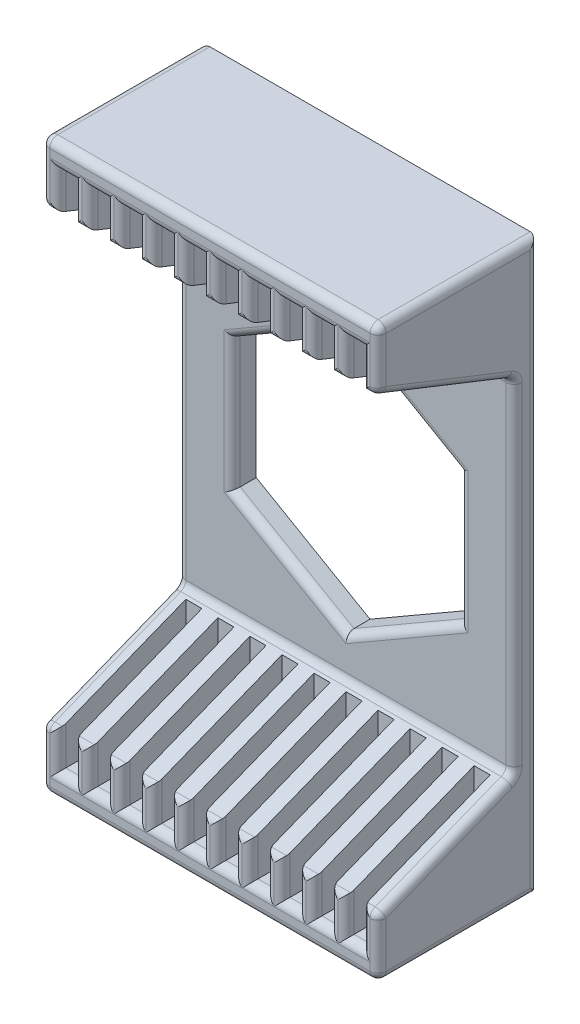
SolidWorks part; units mm, degrees
ref_plane "Front Plane" through (0, 0, 0) normal (1, 0, 0) x (0, 1, 0)
ref_plane "Top Plane" through (0, 0, 0) normal (0, 0, 1) x (0, 1, 0)
ref_plane "Right Plane" through (0, 0, 0) normal (0, 1, 0) x (-1, 0, 0)
sketch "Sketch1" plane through (0, 0, 0) normal (1, 0, 0) x (0, 1, 0)
  line L1 (0, 0) -> (90.17, 0)
  line L2 (0, 0) -> (0, 25.4)
  line L3 (0, 25.4) -> (90.17, 25.4)
  line L4 (90.17, 0) -> (90.17, 25.4)
  dimension "D1" = 90.17
  dimension "D2" = 25.4
extrude "Boss-Extrude1" add sketch "Sketch1" along normal blind 53.34
sketch "Sketch2" plane through (53.34, 0, 0) normal (1, 0, 0) x (0, 1, 0)
  line L0 (9.4138, 25.4) -> (80.7562, 25.4) construction
  line L1 (90.17, 25.4) -> (0, 25.4) construction
  line L2 (45.085, 25.4) -> (45.085, 3.81) construction
  line L3 (17.9566, 3.81) -> (72.2134, 3.81)
  line L4 (72.2134, 3.81) -> (80.7562, 25.4)
  line L5 (80.7562, 25.4) -> (9.4138, 25.4)
  line L6 (9.4138, 25.4) -> (17.9566, 3.81)
  point P5 (45.085, 25.4)
  point P10 (45.085, 3.81)
extrude "Cut-Extrude1" cut sketch "Sketch2" against normal through all
sketch "Sketch4" plane through (0, 0, 25.4) normal (0, 0, 1) x (1, 0, 0)
  line L0 (0, 90.17) -> (2.54, 90.17) construction
  line L1 (53.34, 90.17) -> (0, 90.17) construction
  line L2 (2.54, 90.17) -> (2.54, 86.36) construction
  line L3 (0, 0) -> (2.54, 0) construction
  line L4 (53.34, 0) -> (0, 0) construction
  line L5 (2.54, 0) -> (2.54, 3.81) construction
  line L6 (2.54, 86.36) -> (5.08, 86.36)
  line L7 (5.08, 86.36) -> (5.08, 3.81)
  line L8 (5.08, 3.81) -> (2.54, 3.81)
  line L9 (2.54, 3.81) -> (2.54, 86.36)
  line L10 (7.62, 3.81) -> (7.62, 86.36)
  line L11 (7.62, 86.36) -> (10.16, 86.36)
  line L12 (10.16, 86.36) -> (10.16, 3.81)
  line L13 (10.16, 3.81) -> (7.62, 3.81)
  line L14 (12.7, 3.81) -> (12.7, 86.36)
  line L15 (12.7, 86.36) -> (15.24, 86.36)
  line L16 (15.24, 86.36) -> (15.24, 3.81)
  line L17 (15.24, 3.81) -> (12.7, 3.81)
  line L18 (17.78, 3.81) -> (17.78, 86.36)
  line L19 (17.78, 86.36) -> (20.32, 86.36)
  line L20 (20.32, 86.36) -> (20.32, 3.81)
  line L21 (20.32, 3.81) -> (17.78, 3.81)
  line L22 (22.86, 3.81) -> (22.86, 86.36)
  line L23 (22.86, 86.36) -> (25.4, 86.36)
  line L24 (25.4, 86.36) -> (25.4, 3.81)
  line L25 (25.4, 3.81) -> (22.86, 3.81)
  line L26 (27.94, 3.81) -> (27.94, 86.36)
  line L27 (27.94, 86.36) -> (30.48, 86.36)
  line L28 (30.48, 86.36) -> (30.48, 3.81)
  line L29 (30.48, 3.81) -> (27.94, 3.81)
  line L30 (33.02, 3.81) -> (33.02, 86.36)
  line L31 (33.02, 86.36) -> (35.56, 86.36)
  line L32 (35.56, 86.36) -> (35.56, 3.81)
  line L33 (35.56, 3.81) -> (33.02, 3.81)
  line L34 (38.1, 3.81) -> (38.1, 86.36)
  line L35 (38.1, 86.36) -> (40.64, 86.36)
  line L36 (40.64, 86.36) -> (40.64, 3.81)
  line L37 (40.64, 3.81) -> (38.1, 3.81)
  line L38 (43.18, 3.81) -> (43.18, 86.36)
  line L39 (43.18, 86.36) -> (45.72, 86.36)
  line L40 (45.72, 86.36) -> (45.72, 3.81)
  line L41 (45.72, 3.81) -> (43.18, 3.81)
  line L42 (48.26, 3.81) -> (48.26, 86.36)
  line L43 (48.26, 86.36) -> (50.8, 86.36)
  line L44 (50.8, 86.36) -> (50.8, 3.81)
  line L45 (50.8, 3.81) -> (48.26, 3.81)
  dimension "D1" = 10
extrude "Cut-Extrude2" cut sketch "Sketch4" against normal offset from surface (20.32 mm away) 1.27
fillet "Fillet1" radius 1.27 102 edges at (53.34, 90.17, 12.7) (53.34, 45.085, 0) (53.34, 0, 12.7) (53.34, 13.6852, 14.605) (53.34, 45.085, 3.81) (53.34, 76.4848, 14.605) (0, 45.085, 3.81) (0, 13.6852, 14.605) (0, 0, 12.7) (0, 45.085, 0) (0, 90.17, 12.7) (0, 76.4848, 14.605) (2.54, 83.5581, 25.4) (1.27, 80.7562, 25.4) (0, 85.4631, 25.4) (26.67, 90.17, 25.4) (53.34, 85.4631, 25.4) (52.07, 80.7562, 25.4) (50.8, 83.5581, 25.4) (49.53, 86.36, 25.4) (48.26, 83.5581, 25.4) (46.99, 80.7562, 25.4) (45.72, 83.5581, 25.4) (44.45, 86.36, 25.4) (43.18, 83.5581, 25.4) (41.91, 80.7562, 25.4) (40.64, 83.5581, 25.4) (39.37, 86.36, 25.4) (38.1, 83.5581, 25.4) (36.83, 80.7562, 25.4) (35.56, 83.5581, 25.4) (34.29, 86.36, 25.4) (33.02, 83.5581, 25.4) (31.75, 80.7562, 25.4) (30.48, 83.5581, 25.4) (29.21, 86.36, 25.4) (27.94, 83.5581, 25.4) (26.67, 80.7562, 25.4) (25.4, 83.5581, 25.4) (24.13, 86.36, 25.4) (22.86, 83.5581, 25.4) (21.59, 80.7562, 25.4) (20.32, 83.5581, 25.4) (19.05, 86.36, 25.4) (17.78, 83.5581, 25.4) (16.51, 80.7562, 25.4) (15.24, 83.5581, 25.4) (13.97, 86.36, 25.4) (12.7, 83.5581, 25.4) (11.43, 80.7562, 25.4) (10.16, 83.5581, 25.4) (8.89, 86.36, 25.4) (7.62, 83.5581, 25.4) (6.35, 80.7562, 25.4) (5.08, 83.5581, 25.4) (3.81, 86.36, 25.4) (7.62, 6.6119, 25.4) (8.89, 3.81, 25.4) (10.16, 6.6119, 25.4) (11.43, 9.4138, 25.4) (12.7, 6.6119, 25.4) (13.97, 3.81, 25.4) (15.24, 6.6119, 25.4) (16.51, 9.4138, 25.4) (17.78, 6.6119, 25.4) (19.05, 3.81, 25.4) (20.32, 6.6119, 25.4) (21.59, 9.4138, 25.4) (22.86, 6.6119, 25.4) (24.13, 3.81, 25.4) (25.4, 6.6119, 25.4) (26.67, 9.4138, 25.4) (27.94, 6.6119, 25.4) (29.21, 3.81, 25.4) (30.48, 6.6119, 25.4) (31.75, 9.4138, 25.4) (33.02, 6.6119, 25.4) (34.29, 3.81, 25.4) (35.56, 6.6119, 25.4) (36.83, 9.4138, 25.4) (38.1, 6.6119, 25.4) (39.37, 3.81, 25.4) (40.64, 6.6119, 25.4) (41.91, 9.4138, 25.4) (43.18, 6.6119, 25.4) (44.45, 3.81, 25.4) (45.72, 6.6119, 25.4) (46.99, 9.4138, 25.4) (48.26, 6.6119, 25.4) (49.53, 3.81, 25.4) (50.8, 6.6119, 25.4) (52.07, 9.4138, 25.4) (53.34, 4.7069, 25.4) (26.67, 0, 25.4) (0, 4.7069, 25.4) (1.27, 9.4138, 25.4) (2.54, 6.6119, 25.4) (3.81, 3.81, 25.4) (5.08, 6.6119, 25.4) (6.35, 9.4138, 25.4) (26.67, 17.9566, 3.81) (26.67, 72.2134, 3.81)
sketch "Sketch5" plane through (0, 0, 3.81) normal (0, 0, 1) x (1, 0, 0)
  line L0 (52.07, 71.3501) -> (1.27, 18.8199) construction
  line L2 (26.67, 65.93) -> (8.6177, 55.5075)
  line L3 (8.6177, 55.5075) -> (8.6177, 34.6625)
  line L4 (8.6177, 34.6625) -> (26.67, 24.24)
  line L5 (26.67, 24.24) -> (44.7223, 34.6625)
  line L6 (44.7223, 34.6625) -> (44.7223, 55.5075)
  line L7 (44.7223, 55.5075) -> (26.67, 65.93)
  circle A0 centre (26.67, 45.085) radius 18.0523 construction
extrude "Cut-Extrude3" cut sketch "Sketch5" against normal through all
fillet "Fillet2" radius 1.27 6 edges at (8.6177, 45.085, 3.81) (17.6439, 29.4513, 3.81) (35.6961, 29.4513, 3.81) (44.7223, 45.085, 3.81) (35.6961, 60.7187, 3.81) (17.6439, 60.7187, 3.81)
